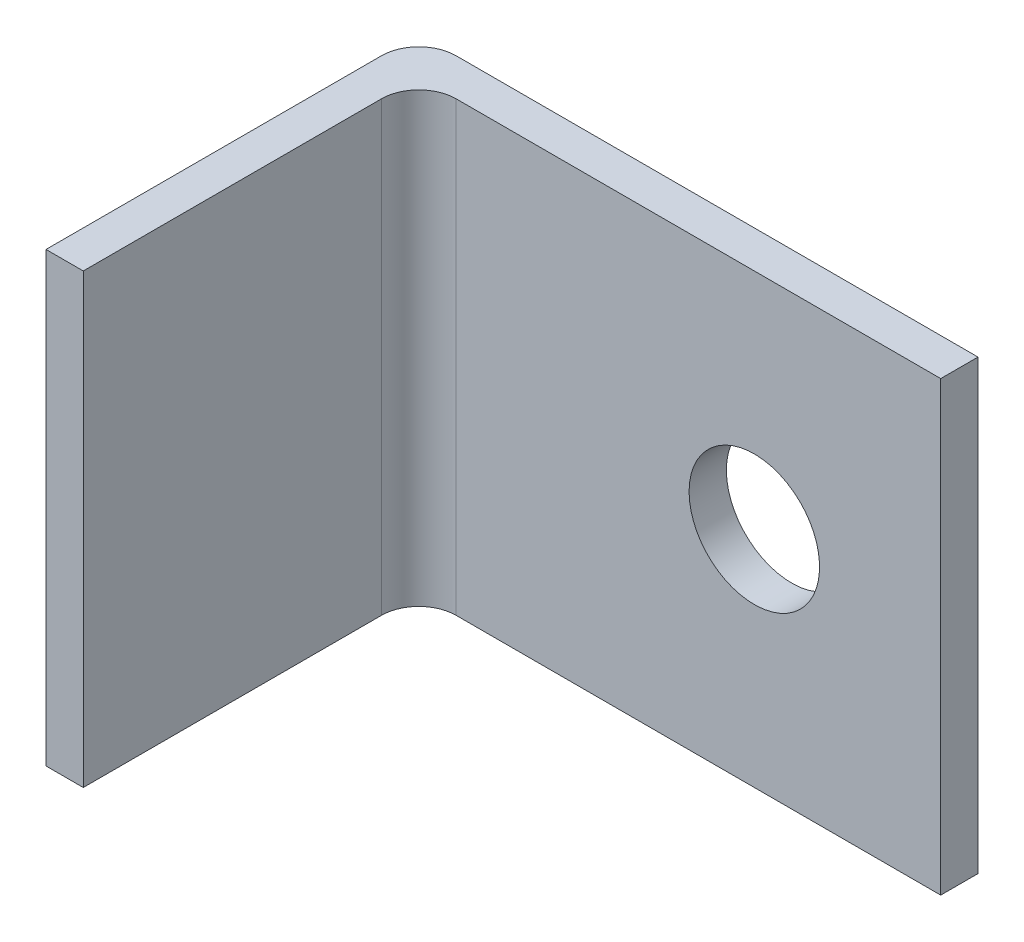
SolidWorks part; units mm, degrees
ref_plane "Front" through (0, 0, 0) normal (0, 0, 1) x (1, 0, 0)
ref_plane "Top" through (0, 0, 0) normal (0, 1, 0) x (1, 0, 0)
ref_plane "Right" through (0, 0, 0) normal (1, 0, 0) x (0, 0, -1)
sketch "Sketch1" plane through (0, 0, 0) normal (0, 1, 0) x (1, 0, 0)
  line L0 (0, 0) -> (0, 10)
  line L1 (0, 10) -> (15, 10)
  line L2 (1, 0) -> (1, 9)
  line L3 (1, 9) -> (15, 9)
  line L4 (0, 0) -> (1, 0)
  line L5 (15, 9) -> (15, 10)
extrude "Extrude1" add sketch "Sketch1" along normal blind 12
sketch "Sketch2" plane through (0, 0, -10) normal (0, 0, -1) x (-1, 0, 0)
  circle A0 centre (-10, 6) radius 1.75
extrude "Cut-Extrude1" cut sketch "Sketch2" against normal blind 12
fillet "Fillet1" radius 1 1 edges at (0, 6, -10)
fillet "Fillet2" radius 1 1 edges at (1, 6, -9)
